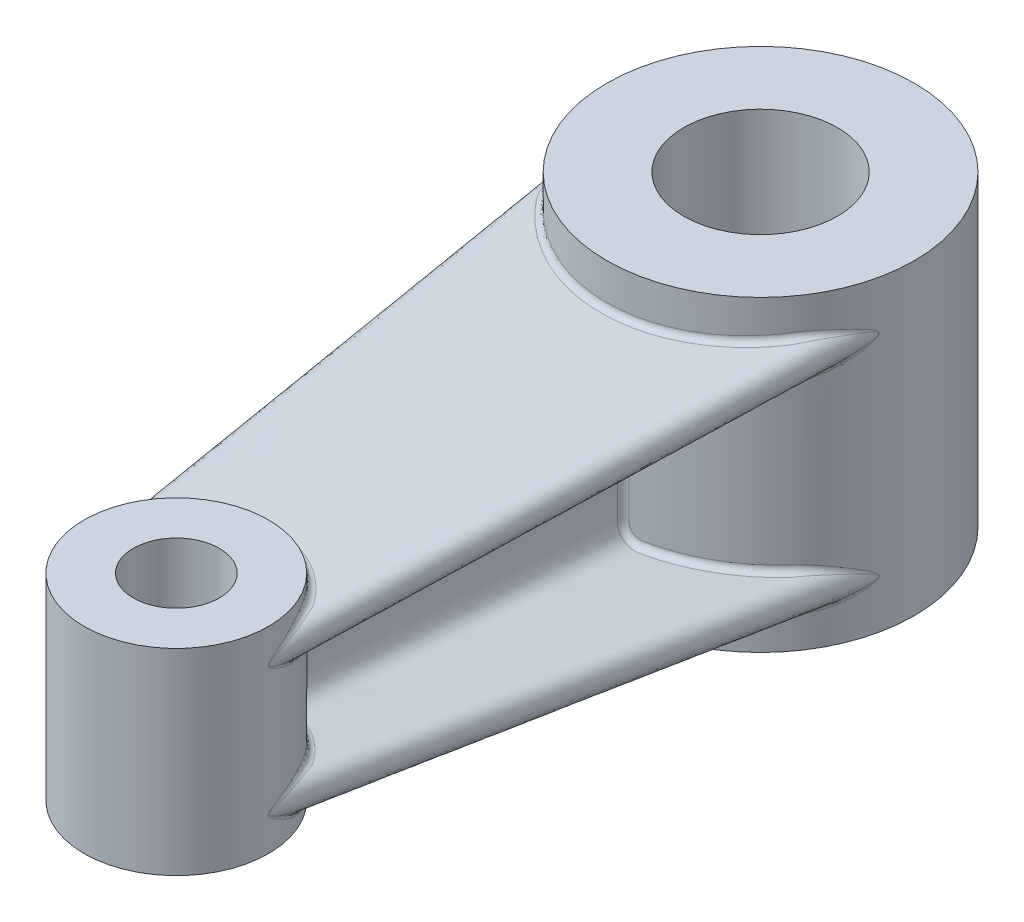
SolidWorks part; units mm, degrees
ref_plane "Front Plane" through (0, 0, 0) normal (0, 0, 1) x (1, 0, 0)
ref_plane "Top Plane" through (0, 0, 0) normal (0, 1, 0) x (1, 0, 0)
ref_plane "Right Plane" through (0, 0, 0) normal (1, 0, 0) x (0, 0, -1)
sketch "Sketch1" plane through (0, 0, 0) normal (0, 1, 0) x (1, 0, 0)
  circle A0 centre (0, 0) radius 15
  dimension "D1" = 30
extrude "Extrude1" add sketch "Sketch1" along normal mid plane 32
sketch "Sketch2" plane through (0, 0, 0) normal (0, 1, 0) x (1, 0, 0)
  line L0 (0, 0) -> (0, 95) construction
  circle A0 centre (0, 95) radius 25
  dimension "D1" = 50
  dimension "D2" = 95
extrude "Extrude2" add sketch "Sketch2" along normal mid plane 50
ref_plane "Plane1" through (0, 0, -95) normal (0, 0, 1) x (1, 0, 0)
sketch "Sketch3" plane through (0, 0, -95) normal (0, 0, 1) x (1, 0, 0)
  line L0 (0, 0) -> (28.4895, 0) construction
  line L1 (22.5, 20) -> (-22.5, 20)
  line L2 (0, 25) -> (0, -32.7501) construction
  line L4 (22.5, -20) -> (-22.5, -20)
  line L5 (5.5, -15) -> (22.5, -15)
  line L6 (-5.5, -15) -> (-22.5, -15)
  line L7 (-2.5, 12) -> (-2.5, -12)
  line L8 (-5.5, 15) -> (-22.5, 15)
  line L10 (2.5, 12) -> (2.5, -12)
  line L11 (15, 0) -> (-15, 0) construction
  line L12 (5.5, 15) -> (22.5, 15)
  line L14 (25, -25) -> (25, 25) construction
  line L16 (25, 25) -> (-25, 25) construction
  arc A0 (22.5, -20) -> (22.5, -15) centre (22.5, -17.5) ccw
  arc A1 (2.5, 12) -> (5.5, 15) centre (5.5, 12) cw
  arc A2 (2.5, -12) -> (5.5, -15) centre (5.5, -12) ccw
  arc A3 (-22.5, -20) -> (-22.5, -15) centre (-22.5, -17.5) cw
  arc A4 (22.5, 20) -> (22.5, 15) centre (22.5, 17.5) cw
  arc A5 (-2.5, -12) -> (-5.5, -15) centre (-5.5, -12) cw
  arc A6 (-2.5, 12) -> (-5.5, 15) centre (-5.5, 12) ccw
  arc A7 (-22.5, 20) -> (-22.5, 15) centre (-22.5, 17.5) ccw
  point P15 (-2.5, 0)
  point P17 (0, 20)
  point P20 (2.5, 0)
  point P21 (2.5, 0)
  point P27 (-2.5, 12)
  point P30 (2.5, 15)
  point P33 (-2.5, -12)
  point P36 (2.5, -12)
  point P44 (0, -20)
  dimension "D4" = 3
  dimension "D1" = 5
  dimension "D2" = 2.5
  dimension "D3" = 5
sketch "Sketch4" plane through (0, 0, 0) normal (0, 0, 1) x (1, 0, 0)
  line L0 (0, 0) -> (-21.1992, 0) construction
  line L1 (15, 0) -> (-15, 0) construction
  line L2 (-12.5, 13) -> (12.5, 13)
  line L4 (15, -16) -> (15, 16) construction
  line L5 (2.5, -5) -> (2.5, 5)
  line L6 (0, 0) -> (0, 30.3484) construction
  line L8 (12.5, 8) -> (5.5, 8)
  line L10 (12.5, -8) -> (5.5, -8)
  line L11 (-12.5, -13) -> (12.5, -13)
  line L12 (-12.5, -8) -> (-5.5, -8)
  line L14 (-2.5, -5) -> (-2.5, 5)
  line L15 (-12.5, 8) -> (-5.5, 8)
  line L18 (15, 16) -> (-15, 16) construction
  line L19 (0, 0) -> (31.3742, 0) construction
  arc A0 (5.5, -8) -> (2.5, -5) centre (5.5, -5) cw
  arc A1 (5.5, 8) -> (2.5, 5) centre (5.5, 5) ccw
  arc A2 (12.5, -13) -> (12.5, -8) centre (12.5, -10.5) ccw
  arc A3 (-12.5, -13) -> (-12.5, -8) centre (-12.5, -10.5) cw
  arc A4 (12.5, 13) -> (12.5, 8) centre (12.5, 10.5) cw
  arc A5 (-5.5, -8) -> (-2.5, -5) centre (-5.5, -5) ccw
  arc A6 (-5.5, 8) -> (-2.5, 5) centre (-5.5, 5) cw
  arc A7 (-12.5, 13) -> (-12.5, 8) centre (-12.5, 10.5) ccw
  point P1 (0, 13)
  point P18 (2.5, 0)
  point P21 (2.5, 0)
  point P50 (0, -13)
  dimension "D3" = 3
  dimension "D1" = 3
  dimension "D2" = 5
loft "Loft1" add profiles "Sketch3", "Sketch4"
hole_wizard "Ø25.0 (25) Diameter Hole1" positions "Sketch7" profile "Sketch6" hole size "Ø25.0" standard "Ansi Metric"
sketch "Sketch7" plane through (0, 25, 0) normal (0, 1, 0) x (-1, 0, 0)
  point P0 (0, -95)
sketch "Sketch6" plane through (0, 25, -95) normal (1, 0, 0) x (0, 0, 1)
  line L0 (0, 0) -> (0, 50)
  line L1 (0, 50) -> (12.5, 50)
  line L2 (12.5, 50) -> (12.5, 0)
  line L5 (12.5, 0) -> (0, 0)
  line L11 (0, -6.35) -> (0, 107.95) construction
  dimension "Thru Hole Dia." = 25
  dimension "Thru Hole Depth" = 50
hole_wizard "Ø14.0 (14) Diameter Hole1" positions "Sketch9" profile "Sketch8" hole size "Ø14.0" standard "Ansi Metric"
sketch "Sketch9" plane through (0, 16, 0) normal (0, 1, 0) x (-1, 0, 0)
  point P0 (0, 0)
sketch "Sketch8" plane through (0, 16, 0) normal (1, 0, 0) x (0, 0, 1)
  line L0 (0, 0) -> (0, 32)
  line L1 (0, 32) -> (7, 32)
  line L2 (7, 32) -> (7, 0)
  line L5 (7, 0) -> (0, 0)
  line L11 (0, -6.35) -> (0, 107.95) construction
  dimension "Thru Hole Dia." = 14
  dimension "Thru Hole Depth" = 32
fillet "Fillet1" radius 1 13 edges at (0.6609, -14.1042, -14.9854) (2.5, -4.3077, -14.7902) (4.809, -13.1095, -70.4669) (-0.6609, 14.1042, -14.9854) (-2.5, -3.5428, -14.7902)
